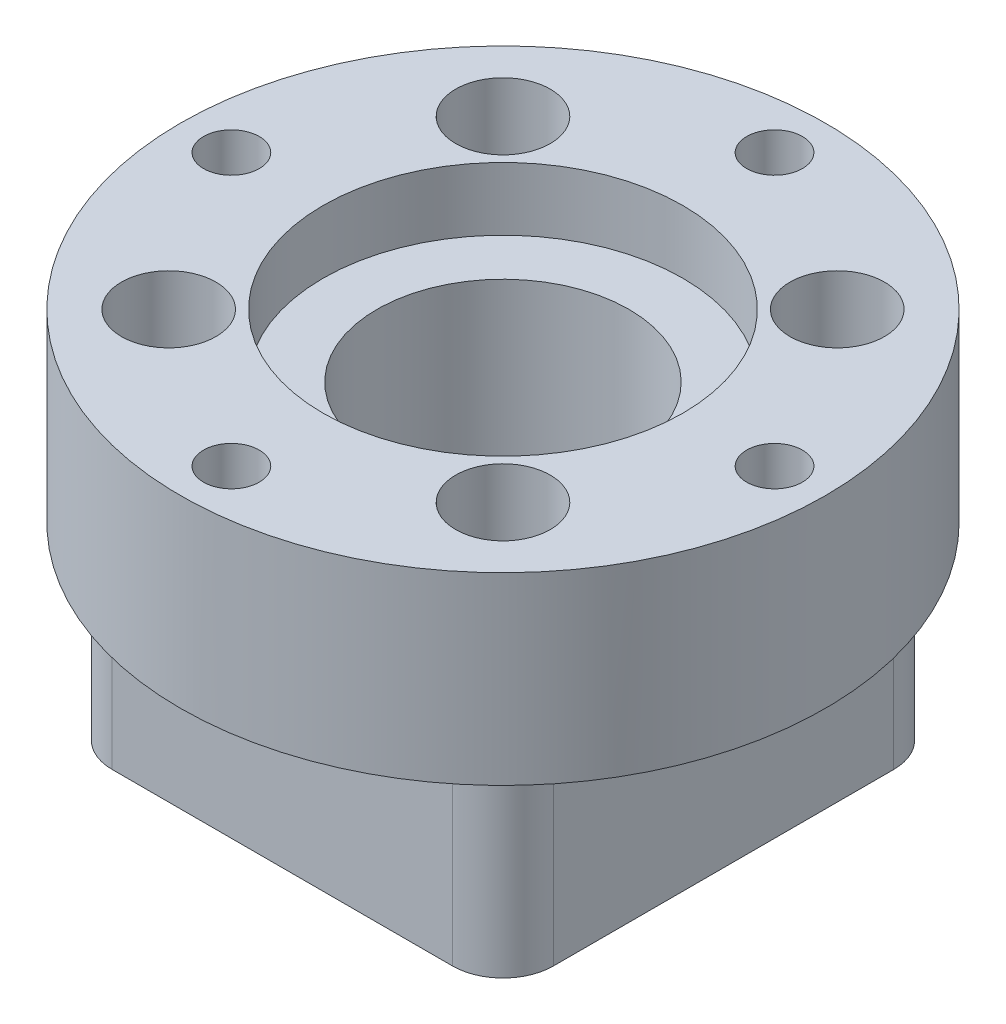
SolidWorks part; units mm, degrees
ref_plane "Front Plane" through (0, 0, 0) normal (0, 0, 1) x (1, 0, 0)
ref_plane "Top Plane" through (0, 0, 0) normal (0, 1, 0) x (1, 0, 0)
ref_plane "Right Plane" through (0, 0, 0) normal (1, 0, 0) x (0, 0, -1)
sketch "Sketch1" plane through (0, 0, 0) normal (0, 1, 0) x (1, 0, 0)
  line L2 (-22.225, -22.225) -> (22.225, -22.225)
  line L3 (-22.225, -22.225) -> (-22.225, 22.225)
  line L4 (-22.225, 22.225) -> (22.225, 22.225)
  line L5 (22.225, -22.225) -> (22.225, 22.225)
  line L6 (-22.225, -22.225) -> (22.225, 22.225) construction
  line L8 (-22.225, 22.225) -> (22.225, -22.225) construction
  dimension "D2" = 44.45
  dimension "D3" = 44.45
extrude "Boss-Extrude1" add sketch "Sketch1" along normal blind 19.05
fillet "Fillet1" radius 5.08 4 edges at (-22.225, 9.525, -22.225) (22.225, 9.525, -22.225) (22.225, 9.525, 22.225) (-22.225, 9.525, 22.225)
sketch "Sketch2" plane through (0, 19.05, 0) normal (0, 1, 0) x (1, 0, 0)
  circle A0 centre (0, 0) radius 32.5
  circle A1 centre (0, 0) radius 32.5 construction
extrude "Boss-Extrude2" add sketch "Sketch2" along normal up to surface (18.5647 mm away)
sketch "Sketch3" plane through (0, 0, 0) normal (0, 0, 1) x (1, 0, 0)
  line L0 (-18.127, 37.6147) -> (-18.127, 31.2647)
  line L1 (32.5, 37.6147) -> (-32.5, 37.6147) construction
  line L2 (-18.127, 37.6147) -> (0, 37.6147)
  line L3 (18.127, 37.6147) -> (-18.127, 37.6147) construction
  line L4 (-19.1008, 7.62) -> (-19.1008, 0)
  line L5 (0, 0) -> (0, 43.476) construction
  line L6 (0, 37.6147) -> (0, 0)
  line L7 (0, 0) -> (-19.1008, 0)
  line L9 (-19.1008, 7.62) -> (-12.7, 7.62)
  line L10 (-12.7, 7.62) -> (-12.7, 31.2647)
  line L11 (-12.7, 31.2647) -> (-18.127, 31.2647)
  dimension "D1" = 38.2016
  dimension "D2" = 36.254
  dimension "D3" = 6.35
  dimension "D4" = 7.62
  dimension "D5" = 25.4
revolve "Cut-Revolve1" cut sketch "Sketch3" angle 360 about L5
hole_wizard "#2 (0.221) Diameter Hole1" positions "Sketch5" profile "Sketch6" hole size "#2" standard "ANSI Inch"
sketch "Sketch5" plane through (0, 37.6147, 0) normal (0, 1, 0) x (1, 0, 0)
  line L2 (-22.225, 0) -> (-32.5, 0) construction
  line L3 (-22.225, 17.145) -> (-22.225, -17.145) construction
  circle A0 centre (0, 0) radius 32.5 construction
  point P0 (-27.3625, 0)
sketch "Sketch6" plane through (-27.3625, 37.6147, 0) normal (1, 0, 0) x (0, 0, 1)
  line L0 (0, 0) -> (0, 18.5657)
  line L1 (0, 18.5657) -> (2.8067, 18.5657)
  line L2 (2.8067, 18.5657) -> (2.8067, 0)
  line L5 (2.8067, 0) -> (0, 0)
  line L11 (0, -6.35) -> (0, 107.95) construction
  dimension "Thru Hole Dia." = 5.6134
  dimension "Thru Hole Depth" = 18.5657
pattern_circular "CirPattern1" count 4 over 360 about axis through (0, 0, 0) along (0, 1, 0) of "#2 (0.221) Diameter Hole1"
hole_wizard "CBORE for #10 Socket Head Cap Screw1" positions "Sketch10" profile "Sketch9" counterbore size "#10" standard "ANSI Inch"
sketch "Sketch10" plane through (1.0329, 37.6147, 8.2753) normal (0, -1, 0) x (-1, 0, 0)
  point P0 (17.8731, -8.5649)
  dimension "D1" = 16.8402
  dimension "D2" = 16.8402
sketch "Sketch9" plane through (-16.8402, 37.6147, 16.8402) normal (1, 0, 0) x (0, 0, 1)
  line L0 (0, 0) -> (0, 37.6147)
  line L1 (0, 37.6147) -> (2.5527, 37.6147)
  line L3 (2.5527, 37.6147) -> (2.5527, 12.7)
  line L4 (2.5527, 12.7) -> (4.7625, 12.7)
  line L5 (4.7625, 12.7) -> (4.7625, 0)
  line L7 (4.7625, 0) -> (0, 0)
  line L11 (0, -6.35) -> (0, 107.95) construction
  dimension "Thru Hole Dia." = 5.1054
  dimension "Thru Hole Depth" = 37.6147
  dimension "C'Bore Dia." = 9.525
  dimension "C'Bore Depth" = 12.7
ref_plane "Plane1" through (0, 0, 0) normal (0.9239, 0, 0.3827) x (0.3827, 0, -0.9239)
pattern_circular "CirPattern2" count 4 over 360 about axis through (0, 0, 0) along (0, 1, 0) of "CBORE for #10 Socket Head Cap Screw1"
